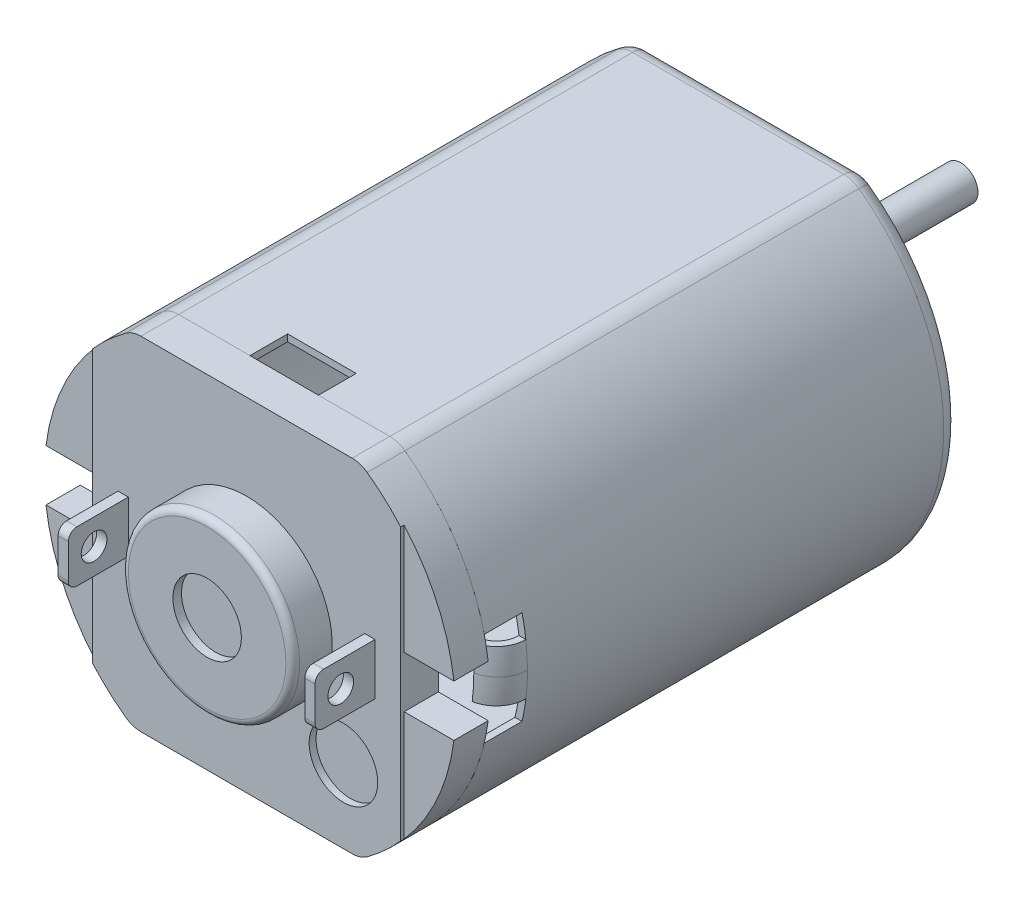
SolidWorks part; units mm, degrees
ref_plane "Front Plane" through (0, 0, 0) normal (0, 0, 1) x (1, 0, 0)
ref_plane "Top Plane" through (0, 0, 0) normal (0, 1, 0) x (1, 0, 0)
ref_plane "Right Plane" through (0, 0, 0) normal (1, 0, 0) x (0, 0, -1)
sketch "Sketch1" plane through (0, 0, 0) normal (0, 0, 1) x (1, 0, 0)
  line L0 (-3.3166, 5) -> (3.3166, 5)
  line L1 (-3.3166, -5) -> (3.3166, -5)
  arc A0 (3.3166, -5) -> (3.3166, 5) centre (0, 0) ccw
  arc A1 (-3.3166, 5) -> (-3.3166, -5) centre (0, 0) ccw
  dimension "D1" = 12
  dimension "D2" = 10
extrude "Boss-Extrude1" add sketch "Sketch1" along normal blind 13.75
fillet "Fillet1" radius 0.75 4 edges at (-3.3166, -5, 6.875) (3.3166, -5, 6.875) (3.3166, 5, 6.875) (-3.3166, 5, 6.875)
fillet "Fillet2" radius 0.5 8 edges at (-3.3137, -4.9634, 0) (-6, 0, 0) (-3.3137, 4.9634, 0) (0, 5, 0) (3.3137, 4.9634, 0) (6, 0, 0) (3.3137, -4.9634, 0) (0, -5, 0)
shell "Shell1" thickness 0.2
sketch "Sketch2" plane through (0, 0, 0) normal (1, 0, 0) x (0, 0, -1)
  line L0 (-1.9238, 0) -> (49998.0762, 0) construction
  line L1 (6.6, 0) -> (-6.6, 0) construction
  line L2 (0, 0) -> (0, 2)
  line L3 (0, 5.5) -> (0, -5.5) construction
  line L4 (0, 2) -> (0.5, 2)
  line L5 (0.5, 2) -> (0.5, 0.5)
  line L6 (0.5, 0.5) -> (6, 0.5)
  line L7 (6, 0.5) -> (6, 0)
  line L8 (6, 0) -> (0, 0)
  dimension "D1" = 1
  dimension "D2" = 6
  dimension "D3" = 0.5
  dimension "D4" = 4
revolve "Revolve1" add sketch "Sketch2" angle 360 about L0
sketch "Sketch4" plane through (0, 0, 0) normal (1, 0, 0) x (0, 0, -1)
  line L0 (-13.75, 4.8571) -> (-13.75, -4.8571) construction
  line L1 (-13.75, 1.375) -> (-12.65, 1.375)
  line L2 (-13.75, 1.375) -> (-13.75, -1.375)
  line L3 (-13.75, -1.375) -> (-12.65, -1.375)
  line L4 (-12.65, 1.375) -> (-12.65, -1.375)
  line L5 (6.6, 0) -> (-6.6, 0) construction
  point P6 (-12.65, 0)
  dimension "D1" = 1.1
  dimension "D2" = 2.75
extrude "Cut-Extrude1" cut sketch "Sketch4" against normal through all both and the other way through all
sketch "Sketch5" plane through (0, 5, 0) normal (0, 1, 0) x (1, 0, 0)
  line L0 (3.0822, -13.75) -> (-3.0822, -13.75) construction
  line L1 (-1, -13.75) -> (1, -13.75)
  line L2 (-1, -13.75) -> (-1, -12.65)
  line L3 (-1, -12.65) -> (1, -12.65)
  line L4 (1, -13.75) -> (1, -12.65)
  line L5 (0, -5.5) -> (0, 5.5) construction
  line L6 (-6, -12.65) -> (-5.8403, -12.65) construction
  point P6 (0, -13.75)
  dimension "D1" = 2
extrude "Cut-Extrude2" cut sketch "Sketch5" against normal up to next
sketch "Sketch7" plane through (0, 0, 0) normal (0, 1, 0) x (1, 0, 0)
  line L0 (5.8, -12.65) -> (6, -12.65)
  line L1 (5.1375, -12.65) -> (5.284, -13.5) construction
  line L2 (5.284, -13.5) -> (5.25, -13.3029)
  line L3 (0, -5.5) -> (0, 5.5) construction
  line L4 (6, -12.65) -> (6, -0.5) construction
  arc A0 (5.25, -13.3029) -> (5.8, -12.65) centre (5.1375, -12.65) ccw
  arc A1 (5.284, -13.5) -> (6, -12.65) centre (5.1375, -12.65) ccw
  dimension "D1" = 5.25
  dimension "D2" = 0.85
sketch "Sketch8" plane through (0, 0, 12.65) normal (0, 0, 1) x (1, 0, 0)
  line L0 (6.6, 0) -> (-6.6, 0) construction
  arc A0 (5.8403, -1.375) -> (5.8403, 1.375) centre (0, 0) ccw construction
  arc A1 (6, 0) -> (5.9529, 0.75) centre (0, 0) ccw
  dimension "D1" = 0.75
sweep "Sweep1" add profiles "Sketch7" path "Sketch8"
mirror "Mirror1" about plane through (0, 0, 0) normal (0, 1, 0) of "Sweep1"
mirror "Mirror2" about plane through (0, 0, 0) normal (1, 0, 0) of "Mirror1", "Sweep1"
sketch "Sketch9" plane through (0, 0, 0) normal (0, 0, -1) x (-1, 0, 0)
  line L0 (0, 5.5) -> (0, -5.5) construction
  line L1 (6.6, 0) -> (-6.6, 0) construction
  line L2 (-3.891, -2.7245) -> (3.891, 2.7245) construction
  circle A3 centre (0, -3.5) radius 0.5
  circle A4 centre (0, 0) radius 4.75 construction
  circle A5 centre (-3.891, -2.7245) radius 0.55
  circle A6 centre (3.891, 2.7245) radius 0.55
  point P2 (0, 0)
  dimension "D1" = 9.5
  dimension "D2" = 1.1
  dimension "D4" = 1
  dimension "D3" = 3.5
  dimension "D5" = 35
extrude "Cut-Extrude3" cut sketch "Sketch9" against normal up to next
sketch "Sketch11" plane through (0, 0, 0.2) normal (0, 0, 1) x (1, 0, 0)
  circle A0 centre (3.891, -2.7245) radius 0.55 construction
  circle A1 centre (-3.891, 2.7245) radius 0.55 construction
  circle A2 centre (3.891, -2.7245) radius 0.55
  circle A3 centre (-3.891, 2.7245) radius 0.55
  circle A4 centre (-3.891, 2.7245) radius 0.8
  circle A5 centre (3.891, -2.7245) radius 0.8
  dimension "D1" = 1.6
extrude "Boss-Extrude3" add sketch "Sketch11" along normal blind 0.3
sketch "Sketch12" plane through (0, 0, 13.75) normal (0, 0, 1) x (1, 0, 0)
  line L0 (-3.0822, -5) -> (3.0822, -5) construction
  line L1 (3.0822, 5) -> (1, 5) construction
  line L2 (1, 5) -> (-1, 5) construction
  line L3 (-1, 5) -> (-3.0822, 5) construction
  line L4 (-3.0822, -5) -> (3.0822, -5)
  line L5 (3.0822, 5) -> (1, 5)
  line L6 (1, 5) -> (-1, 5)
  line L7 (-1, 5) -> (-3.0822, 5)
  line L8 (5.2369, -0.75) -> (5.9529, -0.75) construction
  line L9 (5.9529, 0.75) -> (5.2369, 0.75) construction
  line L10 (4.5, -0.75) -> (5.9529, -0.75)
  line L11 (5.9529, 0.75) -> (4.5, 0.75)
  line L12 (-5.9529, -0.75) -> (-5.2369, -0.75) construction
  line L13 (-5.2369, 0.75) -> (-5.9529, 0.75) construction
  line L14 (-5.9529, -0.75) -> (-4.5, -0.75)
  line L15 (-4.5, 0.75) -> (-5.9529, 0.75)
  line L16 (-4.5, 0.75) -> (-4.5, -0.75)
  line L17 (4.5, 0.75) -> (4.5, -0.75)
  arc A0 (-3.0822, 5) -> (-3.5225, 4.8571) centre (-3.0822, 4.25) ccw construction
  arc A1 (-3.5225, 4.8571) -> (-5.8403, 1.375) centre (0, 0) ccw construction
  arc A2 (-3.5225, -4.8571) -> (-3.0822, -5) centre (-3.0822, -4.25) ccw construction
  arc A3 (3.0822, -5) -> (3.5225, -4.8571) centre (3.0822, -4.25) ccw construction
  arc A4 (5.8403, 1.375) -> (3.5225, 4.8571) centre (0, 0) ccw construction
  arc A5 (3.5225, 4.8571) -> (3.0822, 5) centre (3.0822, 4.25) ccw construction
  arc A6 (-3.5225, -4.8571) -> (-3.0822, -5) centre (-3.0822, -4.25) ccw
  arc A7 (3.0822, -5) -> (3.5225, -4.8571) centre (3.0822, -4.25) ccw
  arc A8 (3.5225, -4.8571) -> (5.9529, -0.75) centre (0, 0) ccw
  arc A9 (3.5225, 4.8571) -> (3.0822, 5) centre (3.0822, 4.25) ccw
  arc A10 (-3.0822, 5) -> (-3.5225, 4.8571) centre (-3.0822, 4.25) ccw
  arc A11 (-3.5225, 4.8571) -> (-5.9529, 0.75) centre (0, 0) ccw
  arc A12 (-5.9529, -0.75) -> (-3.5225, -4.8571) centre (0, 0) ccw
  arc A13 (5.9529, 0.75) -> (3.5225, 4.8571) centre (0, 0) ccw
  dimension "D1" = 9
extrude "Boss-Extrude4" add sketch "Sketch12" along normal blind 1.1 separate body
sketch "Sketch14" plane through (0, 0, 14.85) normal (0, 0, 1) x (1, 0, 0)
  line L0 (-4.5, 3.9686) -> (-4.5, -3.9686)
  line L1 (4.5, 3.9686) -> (4.5, -3.9686)
  line L2 (4.5, -0.75) -> (4.5, 0.75) construction
  line L3 (-4.5, 0.75) -> (-4.5, -0.75) construction
  arc A0 (5.9529, 0.75) -> (3.5225, 4.8571) centre (0, 0) ccw construction
  arc A1 (-3.5225, 4.8571) -> (-5.9529, 0.75) centre (0, 0) ccw construction
  arc A2 (4.5, -3.9686) -> (4.5, 3.9686) centre (0, 0) ccw
  arc A3 (-4.5, 3.9686) -> (-4.5, -3.9686) centre (0, 0) ccw
  arc A4 (-5.9529, -0.75) -> (-3.5225, -4.8571) centre (0, 0) ccw construction
  arc A5 (3.5225, -4.8571) -> (5.9529, -0.75) centre (0, 0) ccw construction
extrude "Cut-Extrude4" cut sketch "Sketch14" against normal blind 0.1
sketch "Sketch15" plane through (0, 0, 0) normal (1, 0, 0) x (0, 0, -1)
  line L0 (-27.3323, 0) -> (49972.6677, 0) construction
  line L1 (6.6, 0) -> (-6.6, 0) construction
  line L2 (-14.85, 2.5) -> (-15.8, 2.5)
  line L3 (-14.85, -3.9686) -> (-14.85, 3.9686) construction
  line L4 (-16, 2.3) -> (-16, 1)
  line L5 (-16, 1) -> (-15.75, 1)
  line L6 (-15.75, 1) -> (-15.75, 0)
  line L7 (-15.75, 0) -> (-14.85, 0)
  line L8 (-14.85, 0) -> (-14.85, 2.5)
  arc A0 (-15.8, 2.5) -> (-16, 2.3) centre (-15.8, 2.3) ccw
  dimension "D1" = 0.2
  dimension "D2" = 1.15
  dimension "D3" = 5
  dimension "D4" = 2
  dimension "D5" = 0.25
revolve "Revolve2" add sketch "Sketch15" angle 360 about L0
sketch "Sketch16" plane through (0, 0, 14.85) normal (0, 0, 1) x (1, 0, 0)
  line L0 (6.6, 0) -> (-6.6, 0) construction
  line L1 (-3.75, 0.75) -> (-3.45, 0.75)
  line L2 (-3.75, 0.75) -> (-3.75, -0.75)
  line L3 (-3.75, -0.75) -> (-3.45, -0.75)
  line L4 (-3.45, 0.75) -> (-3.45, -0.75)
  line L5 (-3.75, 0.75) -> (-3.45, -0.75) construction
  line L6 (-3.75, -0.75) -> (-3.45, 0.75) construction
  line L7 (-3.45, 0.75) -> (3.45, 0.75) construction
  line L8 (3.45, 0.75) -> (3.75, 0.75)
  line L9 (3.45, 0.75) -> (3.45, -0.75)
  line L10 (3.45, -0.75) -> (3.75, -0.75)
  line L11 (3.75, 0.75) -> (3.75, -0.75)
  line L12 (3.45, 0.75) -> (3.75, -0.75) construction
  line L13 (3.45, -0.75) -> (3.75, 0.75) construction
  line L14 (0, -5.5) -> (0, 5.5) construction
  point P0 (-3.6, 0)
  point P7 (3.6, 0)
  point P12 (0, 0.75)
  dimension "D1" = 7.5
  dimension "D2" = 1.5
  dimension "D3" = 0.3
extrude "Boss-Extrude5" add sketch "Sketch16" along normal blind 1.75
sketch "Sketch17" plane through (3.75, 0, 0) normal (1, 0, 0) x (0, 0, -1)
  line L0 (6.6, 0) -> (-6.6, 0) construction
  line L1 (-16.6, -0.75) -> (-16.6, 0.75) construction
  line L2 (-16.6, -0.75) -> (-14.85, -0.75) construction
  circle A0 centre (-15.85, 0) radius 0.75 construction
  circle A1 centre (-15.85, 0) radius 0.375
  dimension "D1" = 0.75
extrude "Cut-Extrude5" cut sketch "Sketch17" against normal up to next
mirror "Mirror3" about plane through (0, 0, 0) normal (1, 0, 0) of "Cut-Extrude5"
fillet "Fillet4" radius 0.25 4 edges at (-3.6, -0.75, 16.6) (-3.6, 0.75, 16.6) (3.6, -0.75, 16.6) (3.6, 0.75, 16.6)
sketch "Sketch18" plane through (0, 0, 14.85) normal (0, 0, 1) x (1, 0, 0)
  line L0 (0, 0) -> (2.8284, -2.8284) construction
  line L1 (0, -5.5) -> (0, 5.5) construction
  circle A0 centre (2.8284, -2.8284) radius 1
  dimension "D1" = 2
  dimension "D2" = 4
  dimension "D3" = 45
extrude "Cut-Extrude6" cut sketch "Sketch18" against normal blind 0.2
